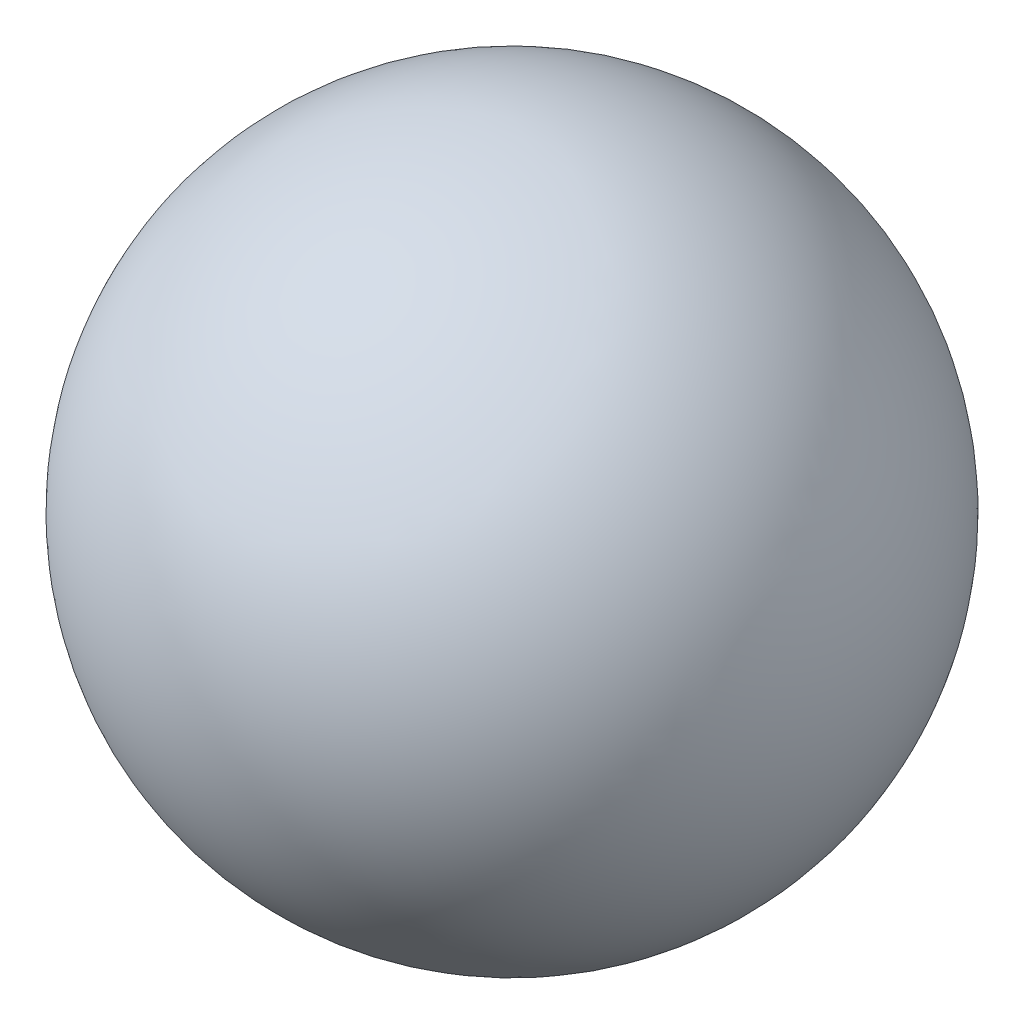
SolidWorks part; units mm, degrees
ref_plane "Plan1" through (0, 0, 0) normal (0, 0, 1) x (1, 0, 0)
ref_plane "Plan2" through (0, 0, 0) normal (0, 1, 0) x (1, 0, 0)
ref_plane "Plan3" through (0, 0, 0) normal (1, 0, 0) x (0, 0, -1)
sketch "Esquisse1" plane through (0, 0, 0) normal (0, 1, 0) x (1, 0, 0)
  line L1 (-0.3, 3.2) -> (6.7, 3.2) construction
  line L2 (-0.3, 6.4) -> (-0.3, 0) construction
  line L3 (6.7, 6.4) -> (6.7, 0) construction
  line L4 (1.1, 3.2) -> (5.3, 3.2)
  circle A1 centre (3.2, 3.2) radius 2.1 construction
  arc A2 (5.3, 3.2) -> (1.1, 3.2) centre (3.2, 3.2) ccw
revolve "Base-Révolution" add sketch "Esquisse1" angle 360 about L1
